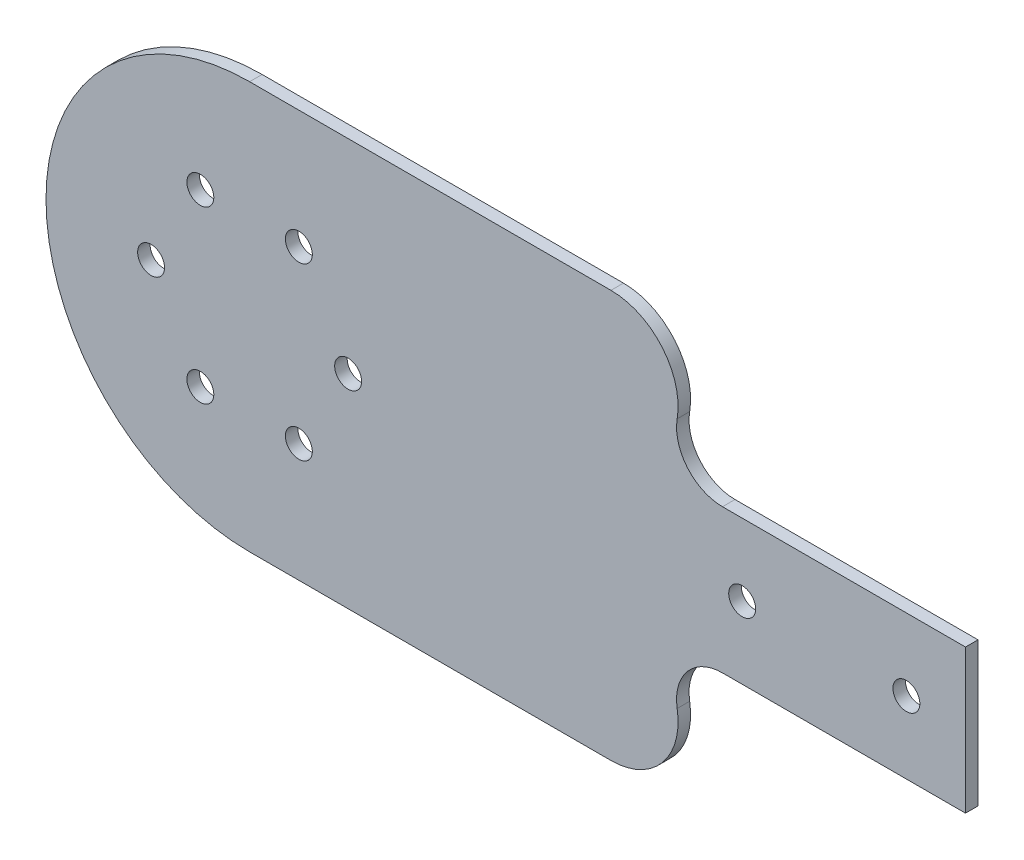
SolidWorks part; units mm, degrees
ref_plane "Front Plane" through (0, 0, 0) normal (1, 0, 0) x (0, 1, 0)
ref_plane "Top Plane" through (0, 0, 0) normal (0, 0, 1) x (0, 1, 0)
ref_plane "Right Plane" through (0, 0, 0) normal (0, 1, 0) x (-1, 0, 0)
sketch "Sketch1" plane through (0, 0, 0) normal (0, 0, 1) x (0, 1, 0)
  line L0 (-31, 0) -> (-31, -55.02)
  line L1 (-10.955, -72) -> (-10.955, -109)
  line L2 (-10.955, -109) -> (10.955, -109)
  line L3 (10.955, -109) -> (10.955, -72)
  line L4 (31, -55.02) -> (31, 0)
  arc A0 (-31, 0) -> (31, 0) centre (0, 0) cw
  arc A2 (-19.0979, -65.1022) -> (-10.955, -72) centre (-17.948, -72) cw
  arc A3 (10.955, -72) -> (19.0979, -65.1022) centre (17.948, -72) cw
  arc A5 (-31, -55.02) -> (-19.0979, -65.1022) centre (-20.7787, -55.02) ccw
  arc A6 (31, -55.02) -> (19.0979, -65.1022) centre (20.7787, -55.02) cw
  point P16 (0, -109)
  dimension "D1" = 31
  dimension "D5" = 140
  dimension "D2" = 55.02
  dimension "D3" = 37
  dimension "D4" = 21.91
extrude "Boss-Extrude1" add sketch "Sketch1" along normal blind 1.905
sketch "Sketch2" plane through (0, 0, 1.905) normal (0, 0, 1) x (1, 0, 0)
  line L0 (0, 0) -> (-15, 0) construction
  line L1 (109, -10.955) -> (109, 10.955) construction
  circle A0 centre (-15, 0) radius 2.05
  circle A1 centre (-7.5, 12.9904) radius 2.05
  circle A2 centre (7.5, 12.9904) radius 2.05
  circle A3 centre (15, 0) radius 2.05
  circle A4 centre (7.5, -12.9904) radius 2.05
  circle A5 centre (-7.5, -12.9904) radius 2.05
  circle A6 centre (100, 0) radius 2.05
  circle A7 centre (75, 0) radius 2.05
  point P20 (109, 0)
  dimension "D1" = 4.1
  dimension "D5" = 25
  dimension "D6" = 4.1
  dimension "D2" = 15
  dimension "D4" = 9
  dimension "D3" = 6
extrude "Cut-Extrude1" cut sketch "Sketch2" against normal through all
